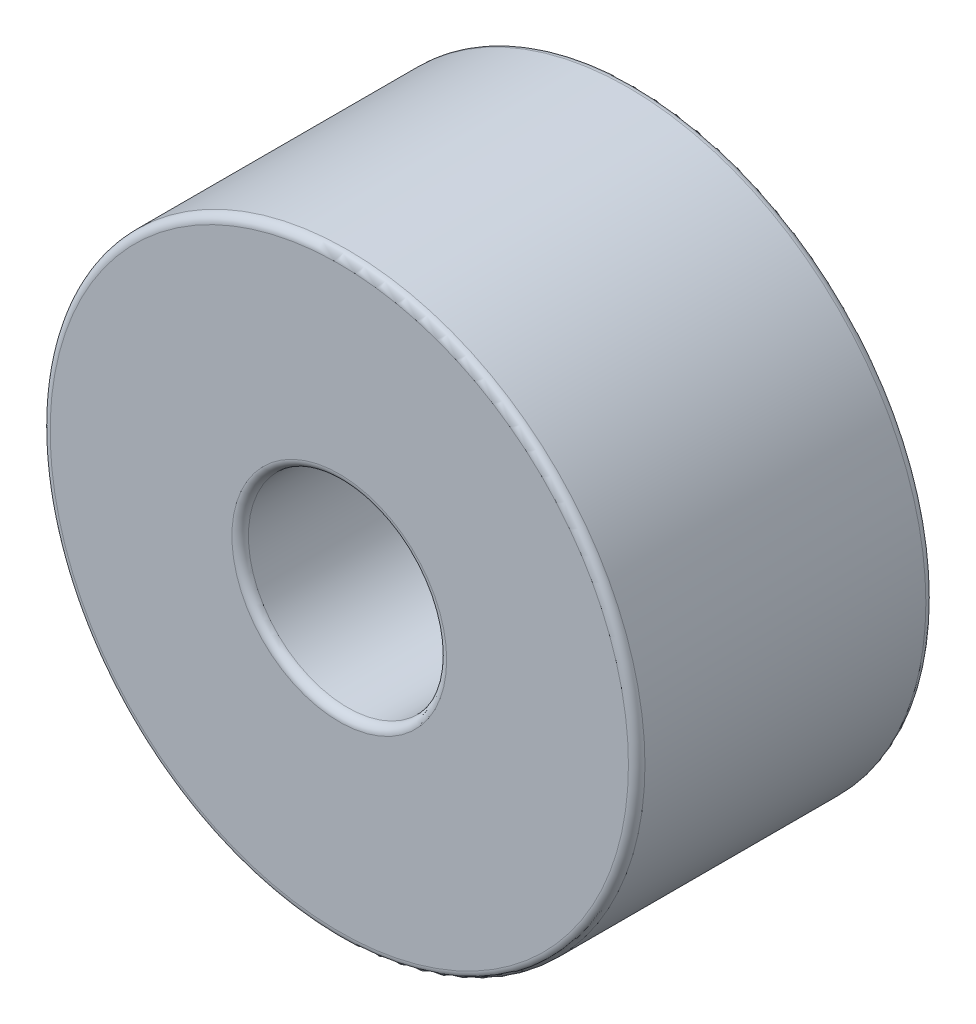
SolidWorks part; units mm, degrees
ref_plane "Plan de face" through (0, 0, 0) normal (0, 0, 1) x (1, 0, 0)
ref_plane "Plan de dessus" through (0, 0, 0) normal (0, 1, 0) x (1, 0, 0)
ref_plane "Plan de droite" through (0, 0, 0) normal (1, 0, 0) x (0, 0, -1)
sketch "Esquisse1" plane through (0, 0, 0) normal (0, 0, 1) x (1, 0, 0)
  circle A0 centre (0, 0) radius 6
  circle A1 centre (0, 0) radius 18
  dimension "D1" = 12
  dimension "D2" = 36
extrude "Extrusion1" add sketch "Esquisse1" along normal blind 18
fillet "Congé1" radius 0.5 4 edges at (18, 0, 0) (18, 0, 18) (6, 0, 0) (6, 0, 18)
